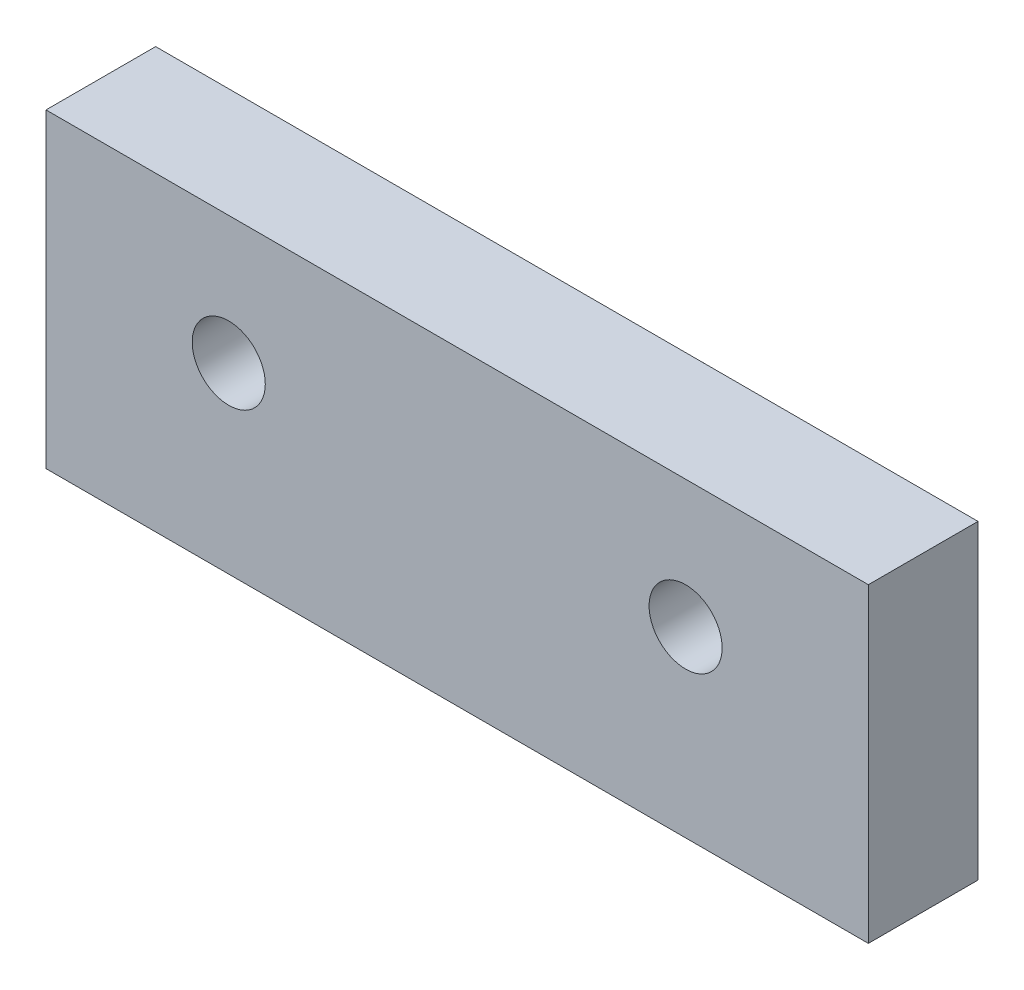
SolidWorks part; units mm, degrees
ref_plane "Plan de face" through (0, 0, 0) normal (0, 0, 1) x (1, 0, 0)
ref_plane "Plan de dessus" through (0, 0, 0) normal (0, 1, 0) x (1, 0, 0)
ref_plane "Plan de droite" through (0, 0, 0) normal (1, 0, 0) x (0, 0, -1)
sketch "Esquisse1" plane through (0, 0, 0) normal (0, 0, 1) x (1, 0, 0)
  line L1 (-22.5, 8.5) -> (22.5, 8.5)
  line L2 (-22.5, 8.5) -> (-22.5, -8.5)
  line L3 (-22.5, -8.5) -> (22.5, -8.5)
  line L4 (22.5, 8.5) -> (22.5, -8.5)
  line L5 (-22.5, 8.5) -> (22.5, -8.5) construction
  line L6 (-22.5, -8.5) -> (22.5, 8.5) construction
  point P0 (0, 0)
  dimension "D1" = 45
  dimension "D2" = 17
extrude "Boss.-Extru.1" add sketch "Esquisse1" along normal blind 6
sketch "Esquisse2" plane through (0, 0, 6) normal (0, 0, 1) x (1, 0, 0)
  line L0 (-22.5, -8.5) -> (22.5, -8.5) construction
  line L1 (-22.5, 8.5) -> (-22.5, -8.5) construction
  circle A0 centre (-12.5, 1.5) radius 2
  dimension "D1" = 10
  dimension "D2" = 4
  dimension "D3" = 10
extrude "Enlèv. mat.-Extru.1" cut sketch "Esquisse2" against normal blind 6
mirror "Symétrie1" about plane through (0, 0, 0) normal (1, 0, 0) of "Enlèv. mat.-Extru.1"
